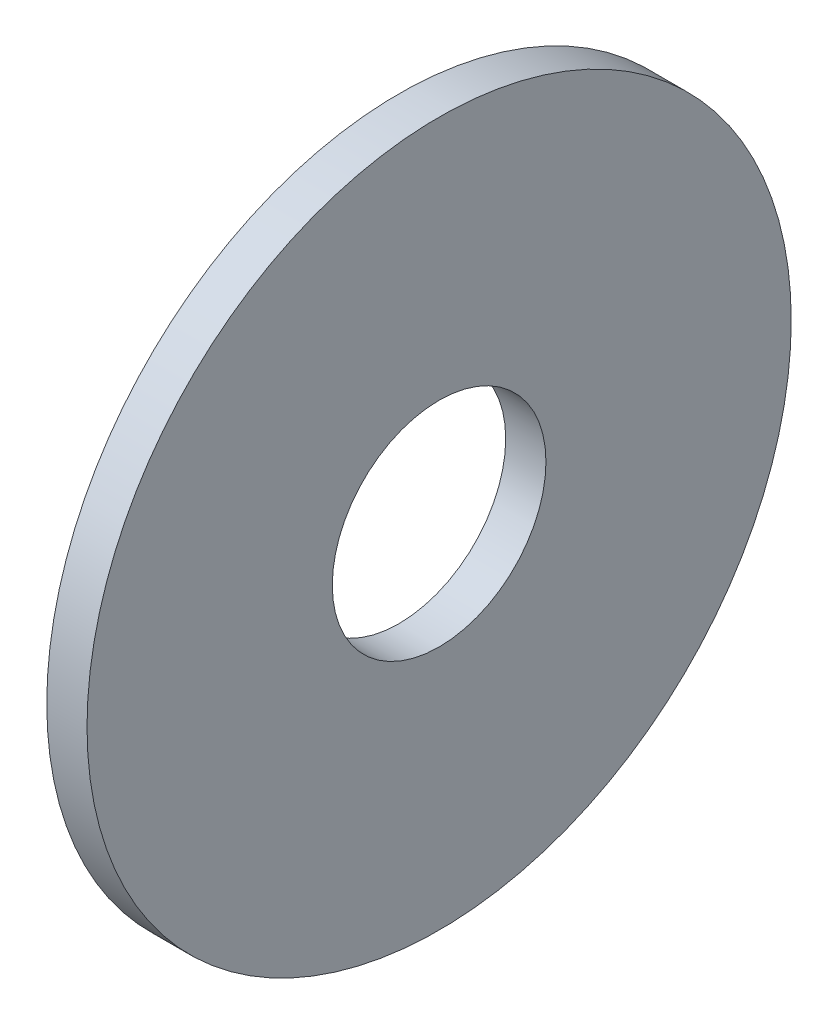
SolidWorks part; units mm, degrees
ref_plane "Plane1" through (0, 0, 0) normal (0, 0, 1) x (1, 0, 0)
ref_plane "Plane2" through (0, 0, 0) normal (0, 1, 0) x (1, 0, 0)
ref_plane "Plane3" through (0, 0, 0) normal (1, 0, 0) x (0, 0, -1)
sketch "Sketch1" plane through (0, 0, 0) normal (0, 0, 1) x (1, 0, 0)
  line L0 (-34.925, 0) -> (9.525, 0) construction
  line L1 (0, 6.7437) -> (0, 22.225)
  line L2 (0, 22.225) -> (-2.54, 22.225)
  line L3 (-2.54, 22.225) -> (-2.54, 6.7437)
  line L4 (-2.54, 6.7437) -> (0, 6.7437)
  dimension "Thickness" = 2.54
  dimension "Inside_dia" = 13.4874
  dimension "Outside_dia" = 44.45
revolve "Base-Revolve" add sketch "Sketch1" angle 360 about L0
